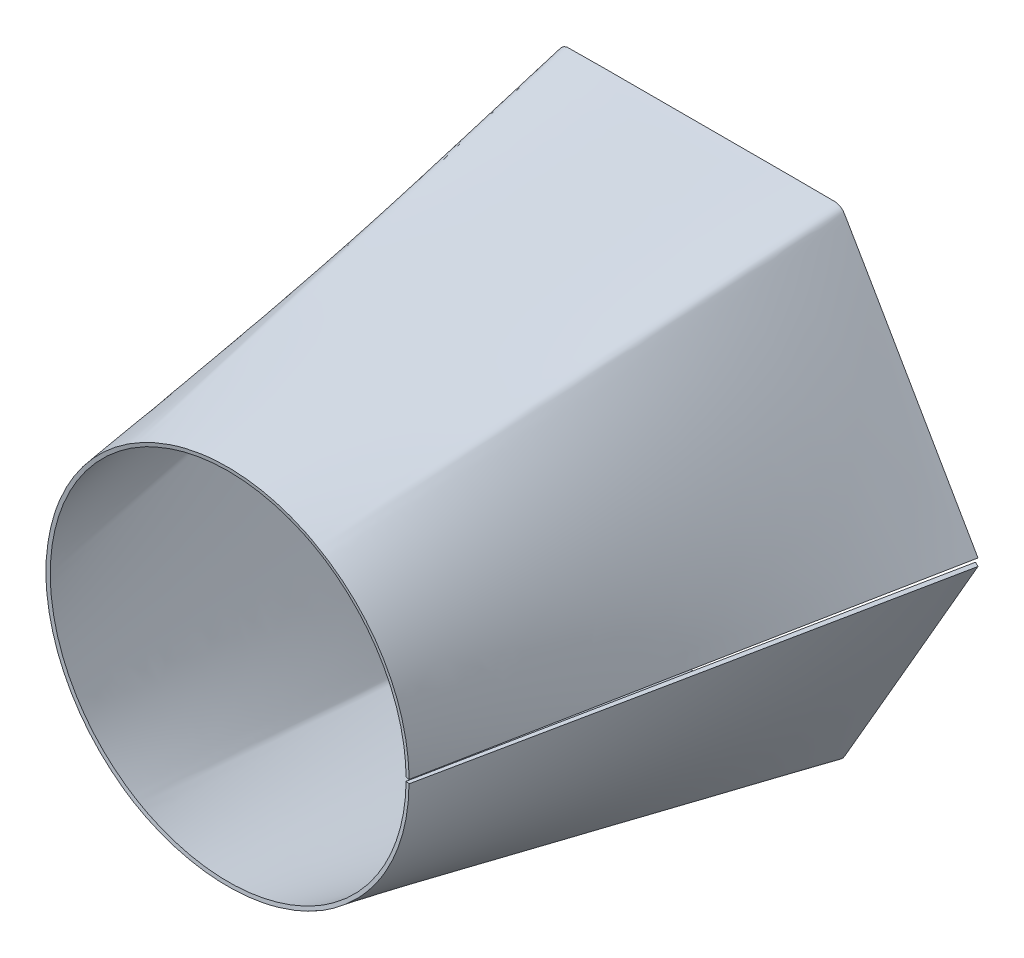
SolidWorks part; units mm, degrees
ref_plane "Front" through (0, 0, 0) normal (0, 0, 1) x (1, 0, 0)
ref_plane "Top" through (0, 0, 0) normal (0, 1, 0) x (1, 0, 0)
ref_plane "Right" through (0, 0, 0) normal (1, 0, 0) x (0, 0, -1)
sketch "ClipBoard" plane through (0, 0, 0) normal (1, 0, 0) x (0, 0, -1)
  line L0 (0, 0) -> (1.5875, 0) construction
  line L1 (0, 0) -> (0, 1.5875) construction
sketch "Inlet" plane through (0, 0, 0) normal (0, 0, 1) x (1, 0, 0)
  line L0 (0, 0) -> (105.8527, 0) construction
  line L1 (116.8593, 0.7937) -> (59.5753, 100.0125)
  line L2 (56.8257, 101.6) -> (-56.8257, 101.6)
  line L3 (-59.5753, 100.0125) -> (-116.401, 1.5875)
  line L4 (-116.401, -1.5875) -> (-59.5753, -100.0125)
  line L5 (-56.8257, -101.6) -> (56.8257, -101.6)
  line L6 (59.5753, -100.0125) -> (116.8593, -0.7937)
  line L7 (0, -0.7937) -> (133.633, -0.7937) construction
  line L8 (0, 0.7937) -> (133.633, 0.7937) construction
  circle A0 centre (0, 0) radius 101.6 construction
  arc A1 (-59.5753, 100.0125) -> (-56.8257, 101.6) centre (-56.8257, 98.425) cw
  arc A2 (-116.401, -1.5875) -> (-116.401, 1.5875) centre (-113.6514, 0) cw
  arc A3 (-56.8257, -101.6) -> (-59.5753, -100.0125) centre (-56.8257, -98.425) cw
  arc A4 (59.5753, -100.0125) -> (56.8257, -101.6) centre (56.8257, -98.425) cw
  arc A5 (56.8257, 101.6) -> (59.5753, 100.0125) centre (56.8257, 98.425) cw
ref_plane "ExitPlane" through (0, 0, 203.2) normal (0, 0, 1) x (1, 0, 0)
sketch "Outlet" plane through (0, 0, 203.2) normal (0, 0, 1) x (1, 0, 0)
  line L0 (0, -0.7937) -> (133.633, -0.7937) construction
  line L1 (0, 0.7937) -> (133.633, 0.7937) construction
  line L2 (0, -0.7937) -> (133.633, -0.7937) construction
  line L3 (0, 0.7937) -> (133.633, 0.7937) construction
  arc A0 (76.1959, 0.7938) -> (76.1959, -0.7938) centre (0, 0) ccw
  dimension "Diameter" = 152.4
sheet metal parameters "Sheet-Metal1" thickness 1.5875 parameters "D1"=0.7366
lofted bend "Transition" parameters "D1"=0, "D12"=1
other "Freeform Bend1" parameters "D1"=1000, "D4"=57.296, "D5"=1
flat pattern "Flat-Pattern1"
sketch "Bend-Lines1" plane through (0, 0, 0) normal (0, 1, 0) x (-1, 0, 0)
other "Flatten-<Freeform Bend1>1"
equation "\"Gap@ClipBoard\" = \"Thickness@ClipBoard\" * 1.0"
equation "\"HalfGap@Inlet\" = \"Gap@ClipBoard\" / 2"
